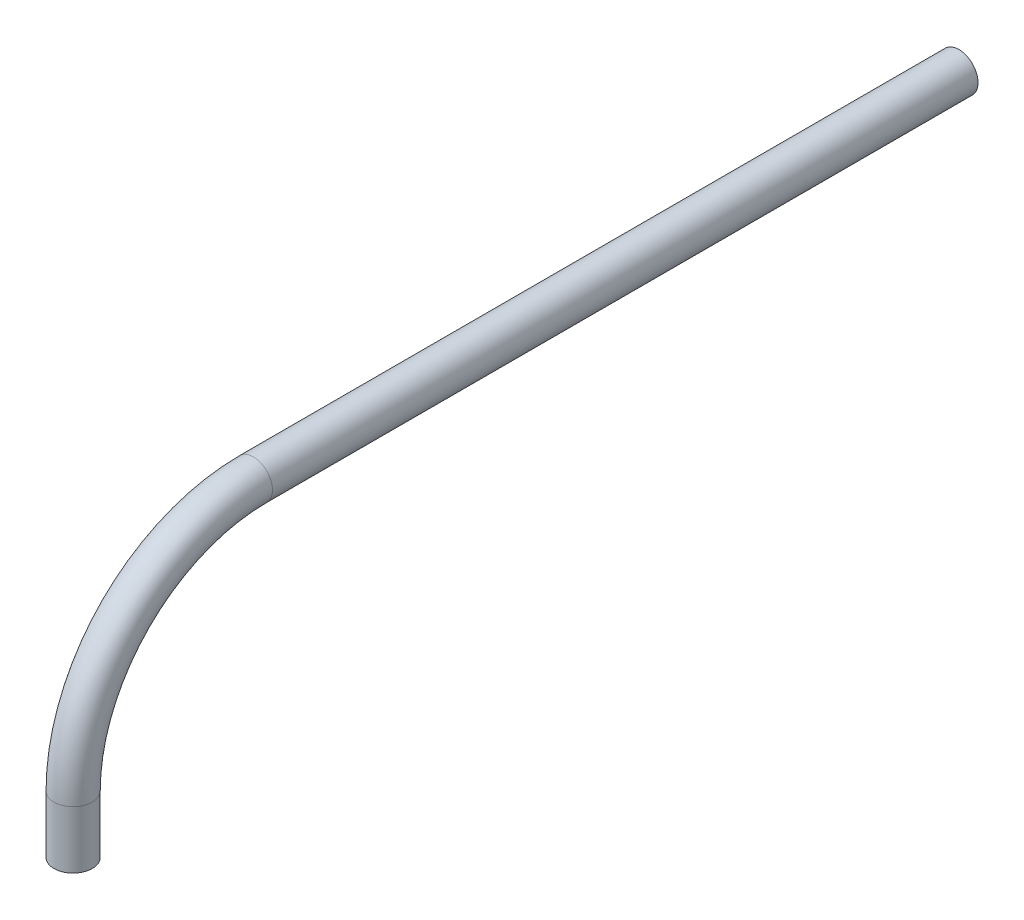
SolidWorks part; units mm, degrees
ref_plane "Front" through (0, 0, 0) normal (0, 0, 1) x (1, 0, 0)
ref_plane "Top" through (0, 0, 0) normal (0, 1, 0) x (1, 0, 0)
ref_plane "Right" through (0, 0, 0) normal (1, 0, 0) x (0, 0, -1)
sketch "Sketch1" plane through (0, 0, 0) normal (0, 0, 1) x (1, 0, 0)
  circle A0 centre (0, 0) radius 7.9375
  circle A1 centre (0, 0) radius 6.2865
  dimension "D1" = 15.875
  dimension "D3" = 12.573
  dimension "D2" = 1.651
sketch "Sketch2" plane through (0, 0, 0) normal (1, 0, 0) x (0, 0, -1)
  line L0 (0, 0) -> (-292.1, 0)
  line L1 (-366.7125, -74.6125) -> (-366.7125, -98.425)
  arc A0 (-292.1, 0) -> (-366.7125, -74.6125) centre (-292.1, -74.6125) ccw
  dimension "D1" = 74.6125
  dimension "D2" = 23.8125
  dimension "D3" = 292.1
sweep "Sweep1" add profiles "Sketch1" path "Sketch2"
chamfer "Chamfer1" distance 0.508 angle 45 1 edges at (6.2865, 0, 0)
equation "\"Buoyancy\"=\"SW-Volume\"*(\"SW-Density\"-.037062)"
